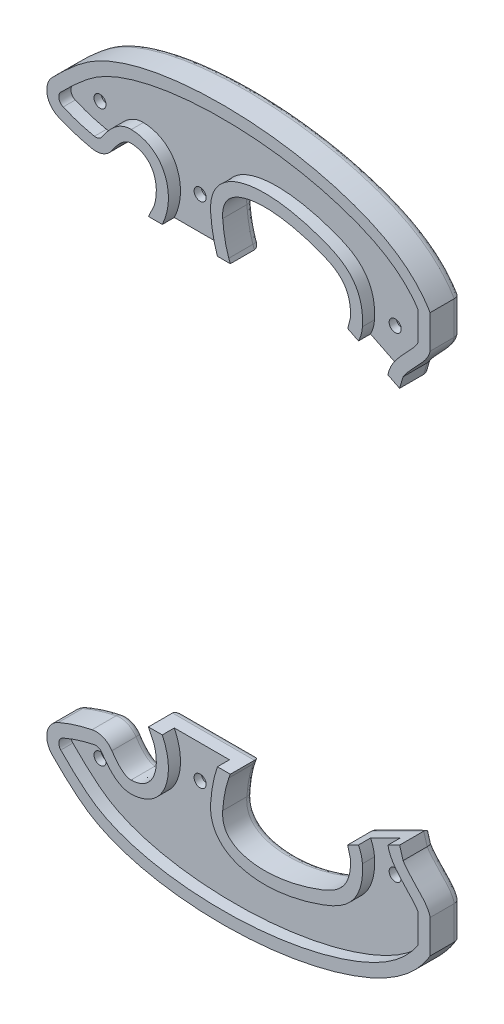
SolidWorks part; units mm, degrees
ref_plane "Front Plane" through (0, 0, 0) normal (0, 0, 1) x (1, 0, 0)
ref_plane "Top Plane" through (0, 0, 0) normal (0, 1, 0) x (1, 0, 0)
ref_plane "Right Plane" through (0, 0, 0) normal (1, 0, 0) x (0, 0, -1)
sketch "Sketch1" plane through (0, 0, 0) normal (0, 0, 1) x (1, 0, 0)
  line L0 (79.2504, -115.4644) -> (79.2504, -101.6424)
  line L5 (0, 0) -> (0, 0)
  line L12 (-35.1375, -96.6123) -> (-37.5102, -91.6123)
  line L13 (68.0435, -86.8465) -> (66.6096, -81.9755)
  line L14 (49.5621, -90.4507) -> (45.0848, -92.6766)
  line L15 (-3.553, -91.6123) -> (-8.908, -91.6123)
  line L16 (-67.1249, -96.6857) -> (-37.5102, -91.6123) construction
  line L17 (-64.2501, -101.266) -> (-37.085, -96.6123) construction
  line L18 (66.6096, -81.9755) -> (81.1993, -47.4105) construction
  line L19 (70.4952, -85.6276) -> (86.1993, -48.4225) construction
  line L20 (81.1993, 47.4105) -> (66.6096, 81.9755) construction
  line L21 (86.1993, 48.4225) -> (70.4952, 85.6276) construction
  line L22 (74.2504, 114.0311) -> (-73.8224, 118.0757) construction
  line L23 (79.2504, 118.8964) -> (-75.3218, 123.1185) construction
  line L30 (-37.5102, -91.6123) -> (-31.761, -91.6123)
  line L31 (74.2504, -114.0311) -> (74.2504, -102.2592)
  line L32 (61.7915, -84.3708) -> (66.6096, -81.9755)
  line L36 (-37.085, -96.6123) -> (-35.1375, -96.6123) construction
  line L37 (-87.8722, -63.9899) -> (-87.8722, -94.5192) construction
  line L38 (-92.8722, -63.9899) -> (-92.8722, -94.5192) construction
  line L39 (-82.8722, -99.5192) -> (-71.6312, -99.5192) construction
  line L40 (-82.8722, -104.5192) -> (-71.6312, -104.5192) construction
  line L41 (68.0435, -86.8465) -> (70.4952, -85.6276) construction
  line L42 (81.1993, -47.4105) -> (81.1993, 47.4105) construction
  line L43 (86.1993, -48.4225) -> (86.1993, 48.4225) construction
  line L44 (-74.6877, 34.8695) -> (-74.6877, -34.8695) construction
  line L45 (-69.6877, 36.0776) -> (-69.6877, -36.0776) construction
  line L46 (-4.0919, -2.8841) -> (-67.1249, 96.6857) construction
  line L47 (0, 0) -> (-62.7714, 99.1566) construction
  line L48 (-56.8037, 110.4905) -> (-48.5642, 116.4338) construction
  line L49 (-53.3217, 106.8371) -> (-50.5489, 108.8371) construction
  line L50 (-48.5642, 116.4338) -> (22.8691, -37.3697) construction
  line L51 (-50.5489, 108.8371) -> (0, 0) construction
  line L52 (-71.6312, 99.5192) -> (-82.8722, 99.5192) construction
  line L53 (-71.6312, 104.5192) -> (-82.8722, 104.5192) construction
  line L54 (-72.8338, 113.2617) -> (-59.8954, 109.2083) construction
  line L55 (-74.5186, 108.5499) -> (-61.2, 104.3774) construction
  line L56 (-92.8722, 94.5192) -> (-92.8722, 63.9899) construction
  line L57 (-87.8722, 94.5192) -> (-87.8722, 63.9899) construction
  line L58 (-78.9079, 54.0436) -> (-69.6877, 36.0776) construction
  line L59 (-82.2731, 49.65) -> (-74.6877, 34.8695) construction
  line L60 (61.7915, 84.3708) -> (74.2504, 102.2592) construction
  line L61 (69.2063, 86.2684) -> (79.2504, 100.6895) construction
  line L62 (74.2504, 102.2592) -> (74.2504, 114.0311) construction
  line L63 (79.2504, 100.6895) -> (79.2504, 118.8964) construction
  line L64 (66.6096, 81.9755) -> (61.7915, 84.3708) construction
  line L65 (70.4952, 85.6276) -> (69.2063, 86.2684) construction
  line L66 (22.8691, -37.3697) -> (-4.0919, -2.8841) construction
  line L67 (-69.6877, -36.0776) -> (-78.9079, -54.0436) construction
  line L68 (-74.6877, -34.8695) -> (-82.2731, -49.65) construction
  line L69 (-4.1958, -93.2842) -> (-3.553, -91.6123)
  line L70 (51.2032, -96.3773) -> (49.5621, -90.4507) construction
  line L71 (46.2395, -97.188) -> (44.7434, -91.785) construction
  line L72 (46.2395, -97.188) -> (45.0848, -92.6766)
  arc A0 (-52.6376, -107.7258) -> (-60.8822, -104.3067) centre (-59.3034, -112.1493) ccw
  arc A1 (-74.8197, -108.673) -> (-77.4561, -121.5104) centre (-71.6422, -116.015) ccw
  arc A27 (-56.8037, -110.4905) -> (-59.8954, -109.2083) centre (-59.3034, -112.1493) ccw
  arc A28 (-72.8338, -113.2617) -> (-73.8224, -118.0757) centre (-71.6422, -116.015) ccw
  arc A30 (-92.8722, -94.5192) -> (-82.8722, -104.5192) centre (-82.8722, -94.5192) ccw construction
  arc A31 (-87.8722, -94.5192) -> (-82.8722, -99.5192) centre (-82.8722, -94.5192) ccw construction
  arc A32 (-71.6312, -104.5192) -> (-64.2501, -101.266) centre (-71.6312, -94.5192) ccw construction
  arc A33 (-71.6312, -99.5192) -> (-67.1249, -96.6857) centre (-71.6312, -94.5192) ccw construction
  arc A34 (-82.8722, 104.5192) -> (-92.8722, 94.5192) centre (-82.8722, 94.5192) ccw construction
  arc A35 (-82.8722, 99.5192) -> (-87.8722, 94.5192) centre (-82.8722, 94.5192) ccw construction
  arc A36 (-61.2, 104.3774) -> (-53.3217, 106.8371) centre (-59.3034, 112.1493) ccw construction
  arc A37 (-59.8954, 109.2083) -> (-56.8037, 110.4905) centre (-59.3034, 112.1493) ccw construction
  arc A38 (-62.7714, 99.1566) -> (-71.6312, 104.5192) centre (-71.6312, 94.5192) ccw construction
  arc A39 (-73.8224, 118.0757) -> (-72.8338, 113.2617) centre (-71.6422, 116.015) ccw construction
  arc A40 (-75.3218, 123.1185) -> (-74.5186, 108.5499) centre (-71.6422, 116.015) ccw construction
  arc A41 (-87.8722, 63.9899) -> (-78.9079, 54.0436) centre (-77.8722, 63.9899) ccw construction
  arc A42 (-92.8722, 63.9899) -> (-82.2731, 49.65) centre (-77.8722, 63.9899) ccw construction
  arc A43 (-67.1249, 96.6857) -> (-71.6312, 99.5192) centre (-71.6312, 94.5192) ccw construction
  arc A44 (-78.9079, -54.0436) -> (-87.8722, -63.9899) centre (-77.8722, -63.9899) ccw construction
  arc A45 (-82.2731, -49.65) -> (-92.8722, -63.9899) centre (-77.8722, -63.9899) ccw construction
  spline S0 degree 1 poles (-35.1375, -96.6123) (-44.7243, -114.2851) knots 0 0 1 1 construction
  spline S1 degree 1 poles (-44.7243, -114.2851) (-52.6376, -107.7258) knots 0 0 1 1 construction
  spline S2 degree 1 poles (-60.8822, -104.3067) (-74.8197, -108.673) knots 0 0 1 1 construction
  spline S3 degree 1 poles (-77.4561, -121.5104) (79.2504, -115.4644) knots 0 0 1 1 construction
  spline S4 degree 1 poles (79.2504, -101.6424) (68.0435, -86.8465) knots 0 0 1 1 construction
  spline S5 degree 1 poles (-4.1958, -93.2842) (-6.7149, -106.2712) knots 0 0 1 1 construction
  spline S6 degree 1 poles (-6.7149, -106.2712) (46.2395, -97.188) knots 0 0 1 1 construction
  spline S8 degree 3 poles (-4.1958, -93.2842) (-4.5548, -94.2961) (-5.1781, -96.3372) (-5.8996, -99.5536) (-6.4155, -102.8759) (-6.6342, -105.1411) (-6.7149, -106.2712) knots 0.844181 0.844181 0.844181 0.844181 0.883136 0.922091 0.961045 1 1 1 1
  spline S9 degree 3 poles (-6.7149, -106.2712) (-6.7402, -106.6253) (-6.7698, -107.3462) (-6.7331, -108.7012) (-6.5053, -110.3043) (-5.9364, -112.0151) (-5.063, -113.5348) (-3.904, -114.8555) (-2.324, -116.1074) (-0.9184, -116.8961) (0.3557, -117.4376) (1.7707, -117.9392) (3.5951, -118.4334) (6.6459, -118.9735) (10.7037, -119.2191) (15.657, -118.9333) (20.6472, -118.1868) (25.6654, -117.0431) (30.6127, -115.5522) (35.5215, -113.7684) (39.6862, -111.7117) (42.8877, -109.0511) (44.67, -106.3305) (45.6122, -103.7779) (46.0621, -101.7216) (46.2801, -99.5126) (46.2739, -97.9551) (46.2395, -97.188) knots 0 0 0 0 0.015522 0.031044 0.062088 0.093132 0.124176 0.155219 0.186263 0.217307 0.232829 0.248351 0.279395 0.310439 0.372527 0.434614 0.496702 0.55879 0.620878 0.682965 0.745053 0.807141 0.869229 0.900272 0.931316 0.96236 0.993404 0.993404 0.993404 0.993404
  spline S16 degree 3 poles (-35.1375, -96.6123) (-34.4895, -98.6761) (-34.0053, -102.0357) (-34.5537, -106.1678) (-35.5655, -108.9609) (-37.1446, -111.25) (-39.2177, -112.9391) (-41.3246, -113.8201) (-43.2063, -114.1966) (-44.2233, -114.2739) (-44.7243, -114.2851) knots 0.632471 0.632471 0.632471 0.632471 0.724353 0.770294 0.816235 0.862176 0.908118 0.954059 0.977029 1 1 1 1
  spline S17 degree 3 poles (-44.7243, -114.2851) (-45.0101, -114.2914) (-45.5611, -114.2422) (-46.8016, -113.8648) (-48.1732, -112.9957) (-49.594, -111.6551) (-50.6289, -110.4898) (-51.652, -109.1674) (-52.3183, -108.207) (-52.6376, -107.7258) knots 0 0 0 0 0.111109 0.222219 0.444438 0.555547 0.666656 0.777766 0.888875 0.888875 0.888875 0.888875
  spline S18 degree 3 poles (-60.8822, -104.3067) (-62.0784, -104.5475) (-64.4598, -105.0944) (-67.9747, -106.0966) (-71.4353, -107.2792) (-73.7005, -108.1887) (-74.8197, -108.673) knots 0.104554 0.104554 0.104554 0.104554 0.275997 0.44744 0.618884 0.790327 0.790327 0.790327 0.790327
  spline S19 degree 3 poles (-77.4561, -121.5104) (-76.2138, -122.8246) (-74.2805, -124.7513) (-71.6518, -127.1769) (-69.0526, -129.5049) (-66.2702, -131.8802) (-63.2175, -134.1302) (-59.928, -136.2642) (-55.7304, -138.4425) (-50.6441, -140.5241) (-45.4894, -142.2138) (-40.2773, -143.5891) (-35.0002, -144.7008) (-27.9955, -145.8593) (-15.7593, -147.1548) (-1.8012, -147.2823) (12.2469, -146.2151) (22.6616, -144.8081) (32.9645, -142.7692) (43.1488, -140.0168) (53.2499, -136.4138) (61.4926, -132.429) (67.7773, -128.2217) (71.4312, -125.1567) (74.1253, -122.4268) (75.7053, -120.5917) (76.9013, -119.0349) (77.6188, -118.021) (78.0999, -117.2952) (78.3744, -116.8668) (78.6267, -116.4628) (78.9027, -116.021) (79.1355, -115.6483) (79.2504, -115.4644) knots 0.024499 0.024499 0.024499 0.024499 0.055248 0.070623 0.085997 0.116746 0.132121 0.147495 0.178244 0.208993 0.239742 0.270491 0.30124 0.331989 0.393487 0.516483 0.577981 0.639479 0.700977 0.762475 0.823973 0.885471 0.91622 0.946969 0.962343 0.977718 0.985405 0.993092 0.996936 0.998858 1.000779 1.004623 1.008467 1.008467 1.008467 1.008467
  spline S20 degree 3 poles (51.2032, -96.3773) (51.1419, -95.3856) (50.9766, -94.4206) (50.5939, -93.0077) (50.4437, -92.5426) (50.1003, -91.6234) (49.9063, -91.1674) (49.6506, -90.6306) (49.6067, -90.5404) (49.5621, -90.4507) knots 0.934325 0.934325 0.934325 0.934325 0.965575 0.965575 0.9812 0.9812 0.996825 0.996825 1 1 1 1
  spline S22 degree 3 poles (-8.908, -91.6123) (-9.2287, -92.5161) (-9.5169, -93.4302) (-10.3038, -96.2246) (-10.7138, -98.1326) (-11.3446, -102.0078) (-11.5623, -103.957) (-11.7022, -105.9149) knots 0.844181 0.844181 0.844181 0.844181 0.875 0.875 0.9375 0.9375 1 1 1 1
  spline S23 degree 3 poles (-11.7022, -105.9149) (-11.7686, -106.8449) (-11.7783, -107.7707) (-11.6596, -109.612) (-11.5314, -110.5275) (-11.211, -111.8914) (-11.0835, -112.3402) (-10.7881, -113.2176) (-10.4516, -114.0774) (-10.0301, -114.9008) (-9.5644, -115.7052) (-9.3081, -116.0995) (-8.4891, -117.2282) (-7.8727, -117.9159) (-6.8554, -118.8624) (-6.4999, -119.1644) (-5.7655, -119.7401) (-5.3893, -120.0118) (-4.2339, -120.7778) (-3.4272, -121.2225) (-2.168, -121.8004) (-1.7402, -121.9784) (-0.8709, -122.3094) (-0.4303, -122.4627) (1.7765, -123.1688) (3.5764, -123.5473) (6.3144, -123.9081) (7.2335, -123.9935) (9.0831, -124.1025) (10.0118, -124.1258) (12.7789, -124.1143) (14.6103, -123.9998) (18.2526, -123.6064) (20.0634, -123.3272) (23.6679, -122.6311) (25.4634, -122.2136) (29.0312, -121.2568) (30.7942, -120.7201) (33.4093, -119.8333) (34.2761, -119.5239) (35.9996, -118.8776) (36.8563, -118.5402) (38.5501, -117.8112) (39.3893, -117.4188) (41.0298, -116.5574) (41.8255, -116.0913) (43.3551, -115.0704) (44.0892, -114.5157) (45.1349, -113.6039) (45.4756, -113.2852) (46.1287, -112.6272) (47.0659, -111.6102) (48.144, -110.1329) (48.822, -108.9326) (49.2447, -108.1117) (49.4421, -107.689) (50.3443, -105.5508) (50.7974, -103.7663) (51.2867, -100.0823) (51.3177, -98.2309) (51.2032, -96.3773) knots 0 0 0 0 0.03125 0.03125 0.0625 0.0625 0.078125 0.078125 0.09375 0.109375 0.109375 0.125 0.125 0.15625 0.15625 0.171875 0.171875 0.1875 0.1875 0.21875 0.21875 0.234375 0.234375 0.25 0.25 0.3125 0.3125 0.34375 0.34375 0.375 0.375 0.4375 0.4375 0.5 0.5 0.5625 0.5625 0.625 0.625 0.65625 0.65625 0.6875 0.6875 0.71875 0.71875 0.75 0.75 0.78125 0.78125 0.796875 0.796875 0.8125 0.84375 0.859375 0.859375 0.875 0.875 0.9375 0.9375 1 1 1 1
  spline S24 degree 3 poles (79.2504, -101.6424) (79.2391, -101.5973) (79.2165, -101.507) (79.1825, -101.3713) (79.1543, -101.259) (79.1314, -101.1673) (79.1181, -101.1143) (79.1067, -101.0686) (79.1039, -101.0576) (79.0976, -101.0321) (79.067, -100.9136) (79.0288, -100.7799) (78.9541, -100.5438) (78.8691, -100.3124) (78.8005, -100.1448) (78.767, -100.0652) (78.7161, -99.9476) (78.6362, -99.7719) (78.4818, -99.456) (78.2777, -99.0828) (78.0458, -98.697) (77.8214, -98.3489) (77.5226, -97.9124) (77.1688, -97.432) (76.6069, -96.7153) (75.9194, -95.9073) (75.1317, -95.0308) (74.0833, -93.9067) (72.8314, -92.6059) (71.4098, -91.1047) (70.104, -89.6462) (69.1513, -88.4679) (68.4794, -87.5303) (68.1863, -87.0797) (68.0435, -86.8465) knots -0.009552 -0.009552 -0.009552 -0.009552 -0.007389 -0.005225 -0.003062 -0.00198 -0.000898 -0.000357 -0.000087 0.000048 0.000184 0.000724 0.001265 0.002347 0.003429 0.00397 0.004511 0.005592 0.007756 0.012083 0.01641 0.020737 0.025064 0.033718 0.042372 0.05968 0.076988 0.094296 0.128911 0.163527 0.198143 0.232759 0.250067 0.267375 0.267375 0.267375 0.267375
  spline S39 degree 3 poles (-31.761, -91.6123) (-31.7177, -91.7008) (-31.675, -91.7896) (-31.4326, -92.3013) (-31.2434, -92.7319) (-30.8902, -93.6013) (-30.7265, -94.0392) (-29.9709, -96.2438) (-29.5631, -98.0553) (-29.3145, -100.3834) (-29.2781, -100.8534) (-29.234, -101.789) (-29.2261, -102.2557) (-29.2457, -103.6521) (-29.3161, -104.5785) (-29.5164, -105.9603) (-29.5991, -106.4197) (-29.7985, -107.3356) (-29.9159, -107.7936) (-30.3172, -109.1415) (-30.651, -110.0113) (-31.2604, -111.2689) (-31.4817, -111.6802) (-31.9634, -112.4858) (-32.2248, -112.8813) (-33.0536, -114.0154) (-33.6693, -114.7102) (-34.6903, -115.6581) (-35.0469, -115.9583) (-35.7939, -116.5259) (-36.1858, -116.7939) (-37.3849, -117.5295) (-38.2236, -117.9359) (-39.5368, -118.4272) (-39.9847, -118.5714) (-40.895, -118.8197) (-41.3533, -118.9228) (-42.7364, -119.1734) (-43.6697, -119.2628) (-44.6129, -119.2838) knots 0.590454 0.590454 0.590454 0.590454 0.59375 0.59375 0.609375 0.609375 0.625 0.625 0.6875 0.6875 0.703125 0.703125 0.71875 0.71875 0.75 0.75 0.765625 0.765625 0.78125 0.78125 0.8125 0.8125 0.828125 0.828125 0.84375 0.84375 0.875 0.875 0.890625 0.890625 0.90625 0.90625 0.9375 0.9375 0.953125 0.953125 0.96875 0.96875 1 1 1 1
  spline S40 degree 3 poles (-44.6129, -119.2838) (-45.3582, -119.3004) (-46.0883, -119.2214) (-47.1633, -118.9755) (-47.5194, -118.8717) (-48.22, -118.6245) (-48.5603, -118.4826) (-49.5551, -118.0093) (-50.1833, -117.6301) (-51.0842, -116.9859) (-51.378, -116.758) (-51.9451, -116.2869) (-52.2197, -116.0429) (-53.5542, -114.787) (-54.5037, -113.6716) (-55.8319, -111.9084) (-56.2573, -111.3058) (-56.7131, -110.6266) (-56.7585, -110.5586) (-56.8037, -110.4905) knots 0 0 0 0 0.125 0.125 0.1875 0.1875 0.25 0.25 0.375 0.375 0.4375 0.4375 0.5 0.5 0.75 0.75 0.875 0.875 0.888875 0.888875 0.888875 0.888875
  spline S41 degree 3 poles (-59.8954, -109.2083) (-60.8367, -109.3978) (-61.7734, -109.609) (-64.3079, -110.2394) (-65.8949, -110.6989) (-69.0293, -111.7354) (-70.5782, -112.3134) (-72.3449, -113.052) (-72.5897, -113.1561) (-72.8338, -113.2617) knots 0.104554 0.104554 0.104554 0.104554 0.25 0.25 0.5 0.5 0.75 0.75 0.790327 0.790327 0.790327 0.790327
  spline S42 degree 3 poles (-73.8224, -118.0757) (-73.5631, -118.3501) (-73.3022, -118.6227) (-71.8246, -120.1473) (-70.5732, -121.361) (-68.6562, -123.1373) (-68.011, -123.7225) (-66.7128, -124.8843) (-66.0609, -125.4622) (-64.0831, -127.1712) (-62.7332, -128.2758) (-60.612, -129.8261) (-59.8891, -130.3252) (-58.4045, -131.2807) (-57.6504, -131.7307) (-55.3624, -133.006) (-53.8014, -133.7608) (-50.6277, -135.132) (-49.0147, -135.7478) (-45.7477, -136.8693) (-44.0935, -137.3747) (-40.7507, -138.2936) (-39.0621, -138.7069) (-36.5067, -139.2667) (-35.6515, -139.4431) (-33.9421, -139.7756) (-33.0869, -139.9319) (-28.8085, -140.6669) (-25.3782, -141.108) (-18.5056, -141.7527) (-15.0631, -141.9555) (-8.1674, -142.1495) (-4.7141, -142.1404) (0.4736, -141.9749) (2.2041, -141.8943) (5.6678, -141.6822) (7.4031, -141.5505) (12.5957, -141.0794) (16.0353, -140.6651) (22.8686, -139.6293) (26.2624, -139.008) (32.9998, -137.538) (36.3434, -136.6896) (42.9717, -134.7265) (46.2567, -133.613) (51.1277, -131.6872) (52.7323, -131.0047) (55.8832, -129.5356) (57.4305, -128.7486) (60.454, -127.0418) (61.93, -126.1218) (64.0786, -124.6197) (64.7853, -124.0976) (66.1593, -123.0211) (66.8284, -122.4658) (68.7782, -120.7452) (70.002, -119.5257) (72.2709, -116.9163) (73.3162, -115.5267) (74.2504, -114.0311) knots 0.024499 0.024499 0.024499 0.024499 0.03125 0.03125 0.0625 0.0625 0.078125 0.078125 0.09375 0.09375 0.125 0.125 0.140625 0.140625 0.15625 0.15625 0.1875 0.1875 0.21875 0.21875 0.25 0.25 0.28125 0.28125 0.296875 0.296875 0.3125 0.3125 0.375 0.375 0.4375 0.4375 0.5 0.5 0.53125 0.53125 0.5625 0.5625 0.625 0.625 0.6875 0.6875 0.75 0.75 0.8125 0.8125 0.84375 0.84375 0.875 0.875 0.90625 0.90625 0.921875 0.921875 0.9375 0.9375 0.96875 0.96875 1 1 1 1
  spline S43 degree 3 poles (74.2504, -102.2592) (74.23, -102.1776) (74.1996, -102.1019) (74.1359, -101.9521) (74.0316, -101.7326) (73.911, -101.5226) (73.6576, -101.1097) (73.4722, -100.844) (72.8904, -100.0621) (72.4729, -99.5665) (71.189, -98.11) (70.2889, -97.1792) (68.5006, -95.3065) (67.609, -94.3666) (65.906, -92.4255) (65.0935, -91.4253) (64.0011, -89.8284) (63.6582, -89.2798) (63.031, -88.138) (62.7504, -87.5505) (62.2774, -86.3501) (62.0846, -85.7349) (61.8826, -84.8619) (61.8335, -84.6171) (61.7915, -84.3708) knots 0 0 0 0 0.003906 0.003906 0.007813 0.015625 0.015625 0.03125 0.03125 0.0625 0.0625 0.125 0.125 0.1875 0.1875 0.25 0.25 0.28125 0.28125 0.3125 0.3125 0.34375 0.34375 0.355726 0.355726 0.355726 0.355726
  dimension "D1" = 5
  dimension "D2" = 5
extrude "Boss-Extrude1" add sketch "Sketch1" against normal blind 13 contours S22 S23 S20 L14 L72 S9 S8 L69 L15 | S41 A28 S42 L31 S43 L32 L13 S24 L0 S19 A1 S18 A0 S17 S16 L12 L30 S39 S40 A27
sketch "Sketch2" plane through (0, 0, -13) normal (0, 0, -1) x (-1, 0, 0)
  line L0 (37.5102, -91.6123) -> (31.761, -91.6123)
  line L1 (31.761, -91.6123) -> (8.908, -91.6123)
  line L2 (-49.5621, -90.4507) -> (-61.7915, -84.3708)
  line L4 (8.908, -91.6123) -> (3.553, -91.6123)
  line L5 (3.553, -91.6123) -> (4.1958, -93.2842)
  line L6 (-74.2504, -114.0311) -> (-74.2504, -102.2592)
  line L7 (-61.7915, -84.3708) -> (-66.6096, -81.9755)
  line L8 (-66.6096, -81.9755) -> (-68.0435, -86.8465)
  line L9 (-79.2504, -101.6424) -> (-79.2504, -115.4644)
  line L10 (35.1375, -96.6123) -> (37.5102, -91.6123)
  line L11 (37.5102, -91.6123) -> (31.761, -91.6123)
  line L13 (-61.7915, -84.3708) -> (-66.6096, -81.9755)
  line L14 (-66.6096, -81.9755) -> (-68.0435, -86.8465)
  line L15 (-79.2504, -101.6424) -> (-79.2504, -115.4644)
  line L16 (35.1375, -96.6123) -> (37.5102, -91.6123)
  line L18 (-46.2395, -97.188) -> (-45.0848, -92.6766)
  line L19 (-45.0848, -92.6766) -> (-49.5621, -90.4507)
  line L20 (8.908, -91.6123) -> (3.553, -91.6123)
  line L21 (3.553, -91.6123) -> (4.1958, -93.2842)
  line L22 (-46.2395, -97.188) -> (-45.0848, -92.6766)
  line L23 (-45.0848, -92.6766) -> (-49.5621, -90.4507)
  circle A0 centre (62.5687, -117.943) radius 2.5
  circle A3 centre (-59.7793, -98.549) radius 2.5
  arc A4 (59.8954, -109.2083) -> (56.8037, -110.4905) centre (59.3034, -112.1493) ccw
  arc A5 (73.8224, -118.0757) -> (72.8338, -113.2617) centre (71.6422, -116.015) ccw
  arc A6 (77.4561, -121.5104) -> (74.8197, -108.673) centre (71.6422, -116.015) ccw
  arc A7 (60.8822, -104.3067) -> (52.6376, -107.7258) centre (59.3034, -112.1493) ccw
  arc A10 (77.4561, -121.5104) -> (74.8197, -108.673) centre (71.6422, -116.015) ccw
  arc A11 (60.8822, -104.3067) -> (52.6376, -107.7258) centre (59.3034, -112.1493) ccw
  circle A13 centre (21.0762, -105.2979) radius 2.5
  spline S5 degree 3 poles (1008.0299, -191.5266) (-136.1442, -284.2891) (24.3373, -181.8322) (10.7138, -98.1326) (10.3038, -96.2246) (-4.4679, -43.7691) (-103.7867, -19.7223) (-980.2961, -238.1044) knots -1.730691 -1.730691 -1.730691 -1.730691 0.906681 0.906681 0.969181 0.969181 2.658415 2.658415 2.658415 2.658415 only from (11.7022, -105.9149) to (8.908, -91.6123)
  spline S6 degree 3 poles (-2552.9308, 2981.4341) (-141.2696, -60.8019) (-8.2535, -36.4555) (5.8996, -99.5536) (17.6026, -174.9224) (-111.6141, -305.7952) (391.6276, 3873.8317) knots -1.331523 -1.331523 -1.331523 -1.331523 0.883136 0.922091 0.961045 3.534279 3.534279 3.534279 3.534279 only from (4.1958, -93.2842) to (6.7149, -106.2712)
  spline S7 degree 3 poles (228.4777, -4099.7196) (-40.3141, -21.3911) (7.3335, -86.5356) (6.7331, -108.7012) (6.5053, -110.3043) (5.9364, -112.0151) (5.063, -113.5348) (3.904, -114.8555) (2.324, -116.1074) (0.9184, -116.8961) (-0.3557, -117.4376) (-1.7707, -117.9392) (-3.5951, -118.4334) (-6.6459, -118.9735) (-10.7037, -119.2191) (-15.657, -118.9333) (-20.6472, -118.1868) (-25.6654, -117.0431) (-30.6127, -115.5522) (-35.5215, -113.7684) (-39.6862, -111.7117) (-42.8877, -109.0511) (-44.67, -106.3305) (-45.6122, -103.7779) (-46.0621, -101.7216) (-49.8737, -63.1119) (46.6808, 30.9134) (-615.9005, -4055.4643) knots -0.953573 -0.953573 -0.953573 -0.953573 0.015522 0.031044 0.062088 0.093132 0.124176 0.155219 0.186263 0.217307 0.232829 0.248351 0.279395 0.310439 0.372527 0.434614 0.496702 0.55879 0.620878 0.682965 0.745053 0.807141 0.869229 0.900272 0.931316 0.96236 2.528052 2.528052 2.528052 2.528052 only from (6.7149, -106.2712) to (-46.2395, -97.188)
  spline S8 degree 3 poles (-792.8836, 578.4832) (125.7681, -105.0665) (-30.6538, -50.7484) (-49.9063, -91.1674) (-50.1003, -91.6234) (-50.4437, -92.5426) (-50.5939, -93.0077) (-59.7681, -126.8739) (44.2134, -189.3273) (887.2273, -441.778) knots -0.462371 -0.462371 -0.462371 -0.462371 0.9375 0.9375 0.953125 0.953125 0.96875 0.96875 2.076719 2.076719 2.076719 2.076719 only from (-49.5621, -90.4507) to (-51.2032, -96.3773)
  spline S9 degree 3 poles (-1051.1251, -83.8977) (101.3942, 8.1233) (-57.8623, -50.5753) (-50.7974, -103.7663) (-50.3443, -105.5508) (-49.4421, -107.689) (-49.2447, -108.1117) (-48.822, -108.9326) (-48.144, -110.1329) (-47.0659, -111.6102) (-46.1287, -112.6272) (-45.4756, -113.2852) (-45.1349, -113.6039) (-44.0892, -114.5157) (-43.3551, -115.0704) (-41.8255, -116.0913) (-41.0298, -116.5574) (-39.3893, -117.4188) (-38.5501, -117.8112) (-36.8563, -118.5402) (-35.9996, -118.8776) (-34.2761, -119.5239) (-33.4093, -119.8333) (-30.7942, -120.7201) (-29.0312, -121.2568) (-25.4634, -122.2136) (-23.6679, -122.6311) (-20.0634, -123.3272) (-18.2526, -123.6064) (-14.6103, -123.9998) (-12.7789, -124.1143) (-10.0118, -124.1258) (-9.0831, -124.1025) (-7.2335, -123.9935) (-6.3144, -123.9081) (-3.5764, -123.5473) (-1.7765, -123.1688) (0.4303, -122.4627) (0.8709, -122.3094) (1.7402, -121.9784) (2.168, -121.8004) (3.4272, -121.2225) (4.2339, -120.7778) (5.3893, -120.0118) (5.7655, -119.7401) (6.4999, -119.1644) (6.8554, -118.8624) (7.8727, -117.9159) (8.4891, -117.2282) (9.3081, -116.0995) (9.5644, -115.7052) (10.0301, -114.9008) (10.4516, -114.0774) (10.7881, -113.2176) (11.0835, -112.3402) (11.211, -111.8914) (11.5314, -110.5275) (11.6596, -109.612) (14.6681, -62.942) (-152.7666, -4.596) (1009.8064, -44.5799) knots -1.679832 -1.679832 -1.679832 -1.679832 0.0625 0.0625 0.125 0.125 0.140625 0.140625 0.15625 0.1875 0.203125 0.203125 0.21875 0.21875 0.25 0.25 0.28125 0.28125 0.3125 0.3125 0.34375 0.34375 0.375 0.375 0.4375 0.4375 0.5 0.5 0.5625 0.5625 0.625 0.625 0.65625 0.65625 0.6875 0.6875 0.75 0.75 0.765625 0.765625 0.78125 0.78125 0.8125 0.8125 0.828125 0.828125 0.84375 0.84375 0.875 0.875 0.890625 0.890625 0.90625 0.921875 0.921875 0.9375 0.9375 0.96875 0.96875 2.521629 2.521629 2.521629 2.521629 only from (-51.2032, -96.3773) to (11.7022, -105.9149)
  spline S10 degree 3 poles (-376.2112, -1009.1032) (-123.6143, -215.1803) (-14.9697, -90.5192) (64.3079, -110.2394) (65.8949, -110.6989) (69.0293, -111.7354) (70.5782, -112.3134) (160.3985, -149.8634) (162.4669, -385.672) (716.6221, 651.931) knots -11.869252 -11.869252 -11.869252 -11.869252 0.25 0.25 0.5 0.5 0.75 0.75 15.259992 15.259992 15.259992 15.259992 only from (59.8954, -109.2083) to (72.8338, -113.2617)
  spline S11 degree 3 poles (895.6522, -687.7918) (112.0267, 65.7348) (126.2936, -63.9497) (71.8246, -120.1473) (70.5732, -121.361) (68.6562, -123.1373) (68.011, -123.7225) (66.7128, -124.8843) (66.0609, -125.4622) (64.0831, -127.1712) (62.7332, -128.2758) (60.612, -129.8261) (59.8891, -130.3252) (58.4045, -131.2807) (57.6504, -131.7307) (55.3624, -133.006) (53.8014, -133.7608) (50.6277, -135.132) (49.0147, -135.7478) (45.7477, -136.8693) (44.0935, -137.3747) (40.7507, -138.2936) (39.0621, -138.7069) (36.5067, -139.2667) (35.6515, -139.4431) (33.9421, -139.7756) (33.0869, -139.9319) (28.8085, -140.6669) (25.3782, -141.108) (18.5056, -141.7527) (15.0631, -141.9555) (8.1674, -142.1495) (4.7141, -142.1404) (-0.4736, -141.9749) (-2.2041, -141.8943) (-5.6678, -141.6822) (-7.4031, -141.5505) (-12.5957, -141.0794) (-16.0353, -140.6651) (-22.8686, -139.6293) (-26.2624, -139.008) (-32.9998, -137.538) (-36.3434, -136.6896) (-42.9717, -134.7265) (-46.2567, -133.613) (-51.1277, -131.6872) (-52.7323, -131.0047) (-55.8832, -129.5356) (-57.4305, -128.7486) (-60.454, -127.0418) (-61.93, -126.1218) (-64.0786, -124.6197) (-64.7853, -124.0976) (-66.1593, -123.0211) (-66.8284, -122.4658) (-68.7782, -120.7452) (-70.002, -119.5257) (-103.2164, -81.3269) (-64.0244, 23.4751) (544.9666, 671.1822) knots -1.338253 -1.338253 -1.338253 -1.338253 0.03125 0.03125 0.0625 0.0625 0.078125 0.078125 0.09375 0.09375 0.125 0.125 0.140625 0.140625 0.15625 0.15625 0.1875 0.1875 0.21875 0.21875 0.25 0.25 0.28125 0.28125 0.296875 0.296875 0.3125 0.3125 0.375 0.375 0.4375 0.4375 0.5 0.5 0.53125 0.53125 0.5625 0.5625 0.625 0.625 0.6875 0.6875 0.75 0.75 0.8125 0.8125 0.84375 0.84375 0.875 0.875 0.90625 0.90625 0.921875 0.921875 0.9375 0.9375 0.96875 0.96875 1.852435 1.852435 1.852435 1.852435 only from (73.8224, -118.0757) to (-74.2504, -114.0311)
  spline S12 degree 3 poles (783.6494, -616.0666) (-73.9419, -110.8566) (-75.6492, -105.5106) (-74.1359, -101.9521) (-74.0316, -101.7326) (-73.911, -101.5226) (-73.6576, -101.1097) (-73.4722, -100.844) (-72.8904, -100.0621) (-72.4729, -99.5665) (-71.189, -98.11) (-70.2889, -97.1792) (-68.5006, -95.3065) (-67.609, -94.3666) (-65.906, -92.4255) (-65.0935, -91.4253) (-64.0011, -89.8284) (-63.6582, -89.2798) (-63.031, -88.138) (-62.7504, -87.5505) (-62.2774, -86.3501) (-62.0846, -85.7349) (-56.8172, -62.9757) (-109.3952, -16.4671) (-359.8779, -1038.9029) knots -0.177819 -0.177819 -0.177819 -0.177819 0.003906 0.003906 0.007813 0.015625 0.015625 0.03125 0.03125 0.0625 0.0625 0.125 0.125 0.1875 0.1875 0.25 0.25 0.28125 0.28125 0.3125 0.3125 0.34375 0.34375 1.439394 1.439394 1.439394 1.439394 only from (-74.2504, -102.2592) to (-61.7915, -84.3708)
  spline S13 degree 3 poles (1788.8167, 3455.8153) (-93.9655, -77.0515) (-57.628, -72.3873) (-69.1513, -88.4679) (-70.104, -89.6462) (-71.4098, -91.1047) (-72.8314, -92.6059) (-74.0833, -93.9067) (-75.1317, -95.0308) (-75.9194, -95.9073) (-76.6069, -96.7153) (-77.1688, -97.432) (-77.5226, -97.9124) (-77.8214, -98.3489) (-78.0458, -98.697) (-78.2777, -99.0828) (-78.4818, -99.456) (-78.6362, -99.7719) (-78.7161, -99.9476) (-78.767, -100.0652) (-78.8005, -100.1448) (-78.8691, -100.3124) (-78.9541, -100.5438) (-79.0288, -100.7799) (-79.067, -100.9136) (-79.0976, -101.0321) (-79.1039, -101.0576) (-79.1067, -101.0686) (-79.1181, -101.1143) (-79.1314, -101.1673) (-79.1543, -101.259) (-79.1825, -101.3713) (-83.4489, -118.4033) (-86.0126, -128.491) (-1031.9607, -3986.4869) knots -1.127686 -1.127686 -1.127686 -1.127686 0.007756 0.025064 0.05968 0.094296 0.128911 0.163527 0.180835 0.198143 0.215451 0.224105 0.232759 0.237086 0.241413 0.24574 0.250067 0.252231 0.253312 0.253853 0.254394 0.255476 0.256558 0.257098 0.257639 0.257774 0.25791 0.25818 0.258721 0.259803 0.260885 0.263048 0.265211 1.075407 1.075407 1.075407 1.075407 only from (-68.0435, -86.8465) to (-79.2504, -101.6424)
  spline S14 degree 3 poles (2033.142, -3510.8449) (-115.3443, -57.5632) (-87.4877, -102.2787) (-78.6267, -116.4628) (-78.3744, -116.8668) (-78.0999, -117.2952) (-77.6188, -118.021) (-76.9013, -119.0349) (-75.7053, -120.5917) (-74.1253, -122.4268) (-71.4312, -125.1567) (-67.7773, -128.2217) (-61.4926, -132.429) (-53.2499, -136.4138) (-43.1488, -140.0168) (-32.9645, -142.7692) (-22.6616, -144.8081) (-12.2469, -146.2151) (1.8012, -147.2823) (15.7593, -147.1548) (27.9955, -145.8593) (35.0002, -144.7008) (40.2773, -143.5891) (45.4894, -142.2138) (50.6441, -140.5241) (55.7304, -138.4425) (59.928, -136.2642) (63.2175, -134.1302) (66.2702, -131.8802) (69.0526, -129.5049) (71.6518, -127.1769) (138.5092, -65.4864) (161.6075, 116.8809) (-3534.535, -1827.7326) knots -0.274381 -0.274381 -0.274381 -0.274381 0.028343 0.032186 0.034108 0.03603 0.039874 0.047561 0.055248 0.070623 0.085997 0.116746 0.147495 0.208993 0.270491 0.331989 0.393487 0.454985 0.516483 0.639479 0.700977 0.731726 0.762475 0.793224 0.823973 0.854722 0.885471 0.900845 0.91622 0.946969 0.962343 0.977718 2.511061 2.511061 2.511061 2.511061 only from (-79.2504, -115.4644) to (77.4561, -121.5104)
  spline S15 degree 3 poles (-3872.408, -485.7961) (195.9377, -569.7541) (197.6135, -150.3969) (67.9747, -106.0966) (-45.8475, -73.6424) (-246.5578, -321.5957) (2911.8353, -2878.5099) knots -18.648167 -18.648167 -18.648167 -18.648167 0.275997 0.44744 0.618884 16.931463 16.931463 16.931463 16.931463 only from (74.8197, -108.673) to (60.8822, -104.3067)
  spline S16 degree 3 poles (-1908.0653, -3593.8626) (77.5242, 12.2149) (71.2644, -83.8189) (50.6289, -110.4898) (49.594, -111.6551) (48.1732, -112.9957) (46.8016, -113.8648) (29.4704, -119.1375) (63.051, -22.9895) (-3943.4597, -405.2082) knots -6.389318 -6.389318 -6.389318 -6.389318 0.111109 0.222219 0.333328 0.444438 0.666656 0.777766 6.653499 6.653499 6.653499 6.653499 only from (52.6376, -107.7258) to (44.7243, -114.2851)
  spline S17 degree 3 poles (-3949.0782, 86.2544) (152.4972, -39.6189) (68.2831, -119.2137) (41.3246, -113.8201) (39.2177, -112.9391) (37.1446, -111.25) (35.5655, -108.9609) (34.5537, -106.1678) (27.5365, -53.2949) (271.2347, 71.4418) (-332.7822, -4073.0764) knots -0.592028 -0.592028 -0.592028 -0.592028 0.655441 0.678412 0.724353 0.770294 0.816235 0.862176 0.908118 3.167639 3.167639 3.167639 3.167639 only from (44.7243, -114.2851) to (35.1375, -96.6123)
  spline S18 degree 3 poles (965.6073, -449.2812) (258.0822, -92.4691) (56.5777, -39.2155) (31.4326, -92.3013) (31.2434, -92.7319) (30.8902, -93.6013) (30.7265, -94.0392) (29.9709, -96.2438) (29.5631, -98.0553) (29.3145, -100.3834) (29.2781, -100.8534) (29.234, -101.789) (29.2261, -102.2557) (29.2457, -103.6521) (29.3161, -104.5785) (29.5164, -105.9603) (29.5991, -106.4197) (29.7985, -107.3356) (29.9159, -107.7936) (30.3172, -109.1415) (30.651, -110.0113) (31.2604, -111.2689) (31.4817, -111.6802) (31.9634, -112.4858) (32.2248, -112.8813) (33.0536, -114.0154) (33.6693, -114.7102) (34.6903, -115.6581) (35.0469, -115.9583) (35.7939, -116.5259) (36.1858, -116.7939) (37.3849, -117.5295) (38.2236, -117.9359) (39.5368, -118.4272) (39.9847, -118.5714) (40.895, -118.8197) (41.3533, -118.9228) (94.2254, -128.5052) (182.8992, 113.1829) (58.7737, -1119.1607) knots -1.353395 -1.353395 -1.353395 -1.353395 0.59375 0.59375 0.609375 0.609375 0.625 0.625 0.6875 0.6875 0.703125 0.703125 0.71875 0.71875 0.75 0.75 0.765625 0.765625 0.78125 0.78125 0.8125 0.8125 0.828125 0.828125 0.84375 0.84375 0.875 0.875 0.890625 0.890625 0.90625 0.90625 0.9375 0.9375 0.953125 0.953125 0.96875 0.96875 2.744982 2.744982 2.744982 2.744982 only from (31.761, -91.6123) to (44.6129, -119.2838)
  spline S19 degree 3 poles (-192.7515, 852.1353) (-28.1311, -6.367) (19.2669, -125.3565) (47.1633, -118.9755) (47.5194, -118.8717) (48.22, -118.6245) (48.5603, -118.4826) (49.5551, -118.0093) (50.1833, -117.6301) (51.0842, -116.9859) (51.378, -116.758) (51.9451, -116.2869) (52.2197, -116.0429) (53.5542, -114.787) (54.5037, -113.6716) (55.8319, -111.9084) (56.2573, -111.3058) (84.9905, -68.4909) (44.321, 19.6252) (963.9419, -531.3042) knots -4.678167 -4.678167 -4.678167 -4.678167 0.125 0.125 0.1875 0.1875 0.25 0.25 0.375 0.375 0.4375 0.4375 0.5 0.5 0.75 0.75 0.875 0.875 9.504082 9.504082 9.504082 9.504082 only from (44.6129, -119.2838) to (56.8037, -110.4905)
  spline S23 degree 3 poles (-68.0435, -86.8465) (-68.1863, -87.0797) (-68.4794, -87.5303) (-69.1513, -88.4679) (-70.104, -89.6462) (-71.4098, -91.1047) (-72.8314, -92.6059) (-74.0833, -93.9067) (-75.1317, -95.0308) (-75.9194, -95.9073) (-76.6069, -96.7153) (-77.1688, -97.432) (-77.5226, -97.9124) (-77.8214, -98.3489) (-78.0458, -98.697) (-78.2777, -99.0828) (-78.4818, -99.456) (-78.6362, -99.7719) (-78.7161, -99.9476) (-78.767, -100.0652) (-78.8005, -100.1448) (-78.8691, -100.3124) (-78.9541, -100.5438) (-79.0288, -100.7799) (-79.067, -100.9136) (-79.0976, -101.0321) (-79.1039, -101.0576) (-79.1067, -101.0686) (-79.1181, -101.1143) (-79.1314, -101.1673) (-79.1543, -101.259) (-79.1825, -101.3713) (-79.2165, -101.507) (-79.2391, -101.5973) (-79.2504, -101.6424) knots -0.009552 -0.009552 -0.009552 -0.009552 0.007756 0.025064 0.05968 0.094296 0.128911 0.163527 0.180835 0.198143 0.215451 0.224105 0.232759 0.237086 0.241413 0.24574 0.250067 0.252231 0.253312 0.253853 0.254394 0.255476 0.256558 0.257098 0.257639 0.257774 0.25791 0.25818 0.258721 0.259803 0.260885 0.263048 0.265211 0.267375 0.267375 0.267375 0.267375
  spline S24 degree 3 poles (-79.2504, -115.4644) (-79.1355, -115.6483) (-78.9027, -116.021) (-78.6267, -116.4628) (-78.3744, -116.8668) (-78.0999, -117.2952) (-77.6188, -118.021) (-76.9013, -119.0349) (-75.7053, -120.5917) (-74.1253, -122.4268) (-71.4312, -125.1567) (-67.7773, -128.2217) (-61.4926, -132.429) (-53.2499, -136.4138) (-43.1488, -140.0168) (-32.9645, -142.7692) (-22.6616, -144.8081) (-12.2469, -146.2151) (1.8012, -147.2823) (15.7593, -147.1548) (27.9955, -145.8593) (35.0002, -144.7008) (40.2773, -143.5891) (45.4894, -142.2138) (50.6441, -140.5241) (55.7304, -138.4425) (59.928, -136.2642) (63.2175, -134.1302) (66.2702, -131.8802) (69.0526, -129.5049) (71.6518, -127.1769) (74.2805, -124.7513) (76.2138, -122.8246) (77.4561, -121.5104) knots 0.024499 0.024499 0.024499 0.024499 0.028343 0.032186 0.034108 0.03603 0.039874 0.047561 0.055248 0.070623 0.085997 0.116746 0.147495 0.208993 0.270491 0.331989 0.393487 0.454985 0.516483 0.639479 0.700977 0.731726 0.762475 0.793224 0.823973 0.854722 0.885471 0.900845 0.91622 0.946969 0.962343 0.977718 1.008467 1.008467 1.008467 1.008467
  spline S25 degree 3 poles (74.8197, -108.673) (73.7005, -108.1887) (71.4353, -107.2792) (67.9747, -106.0966) (64.4598, -105.0944) (62.0784, -104.5475) (60.8822, -104.3067) knots 0.104554 0.104554 0.104554 0.104554 0.275997 0.44744 0.618884 0.790327 0.790327 0.790327 0.790327
  spline S26 degree 3 poles (52.6376, -107.7258) (52.3183, -108.207) (51.652, -109.1674) (50.6289, -110.4898) (49.594, -111.6551) (48.1732, -112.9957) (46.8016, -113.8648) (45.5611, -114.2422) (45.0101, -114.2914) (44.7243, -114.2851) knots 0 0 0 0 0.111109 0.222219 0.333328 0.444438 0.666656 0.777766 0.888875 0.888875 0.888875 0.888875
  spline S27 degree 3 poles (44.7243, -114.2851) (44.2233, -114.2739) (43.2063, -114.1966) (41.3246, -113.8201) (39.2177, -112.9391) (37.1446, -111.25) (35.5655, -108.9609) (34.5537, -106.1678) (34.0053, -102.0357) (34.4895, -98.6761) (35.1375, -96.6123) knots 0.632471 0.632471 0.632471 0.632471 0.655441 0.678412 0.724353 0.770294 0.816235 0.862176 0.908118 1 1 1 1
  spline S31 degree 3 poles (4.1958, -93.2842) (4.5548, -94.2961) (5.1781, -96.3372) (5.8996, -99.5536) (6.4155, -102.8759) (6.6342, -105.1411) (6.7149, -106.2712) knots 0.844181 0.844181 0.844181 0.844181 0.883136 0.922091 0.961045 1 1 1 1
  spline S32 degree 3 poles (6.7149, -106.2712) (6.7402, -106.6253) (6.7698, -107.3462) (6.7331, -108.7012) (6.5053, -110.3043) (5.9364, -112.0151) (5.063, -113.5348) (3.904, -114.8555) (2.324, -116.1074) (0.9184, -116.8961) (-0.3557, -117.4376) (-1.7707, -117.9392) (-3.5951, -118.4334) (-6.6459, -118.9735) (-10.7037, -119.2191) (-15.657, -118.9333) (-20.6472, -118.1868) (-25.6654, -117.0431) (-30.6127, -115.5522) (-35.5215, -113.7684) (-39.6862, -111.7117) (-42.8877, -109.0511) (-44.67, -106.3305) (-45.6122, -103.7779) (-46.0621, -101.7216) (-46.2801, -99.5126) (-46.2739, -97.9551) (-46.2395, -97.188) knots 0 0 0 0 0.015522 0.031044 0.062088 0.093132 0.124176 0.155219 0.186263 0.217307 0.232829 0.248351 0.279395 0.310439 0.372527 0.434614 0.496702 0.55879 0.620878 0.682965 0.745053 0.807141 0.869229 0.900272 0.931316 0.96236 0.993404 0.993404 0.993404 0.993404
  dimension "D1" = 0
  dimension "D2" = 0
extrude "Boss-Extrude2" add sketch "Sketch2" against normal blind 8
fillet "Fillet1" radius 3 15 edges at (-79.4787, -114.4056, -13) (-56.2387, -104.7596, -13) (45.6622, -94.9323, -13) (55.8472, -87.326, -13) (67.3265, -84.411, -13) (79.2504, -108.5534, -13) (-36.3239, -94.1123, -13) (-20.5316, -91.6123, -13)
sketch "Sketch3" plane through (0, 0, -13) normal (0, 0, -1) x (-1, 0, 0)
  circle A0 centre (21.0762, -105.2979) radius 5
  circle A1 centre (-59.7793, -98.549) radius 5
  circle A2 centre (62.5687, -117.943) radius 5
extrude "Cut-Extrude1" cut sketch "Sketch3" against normal blind 5
mirror "Mirror1" about plane through (0, 0, 0) normal (0, 1, 0)
